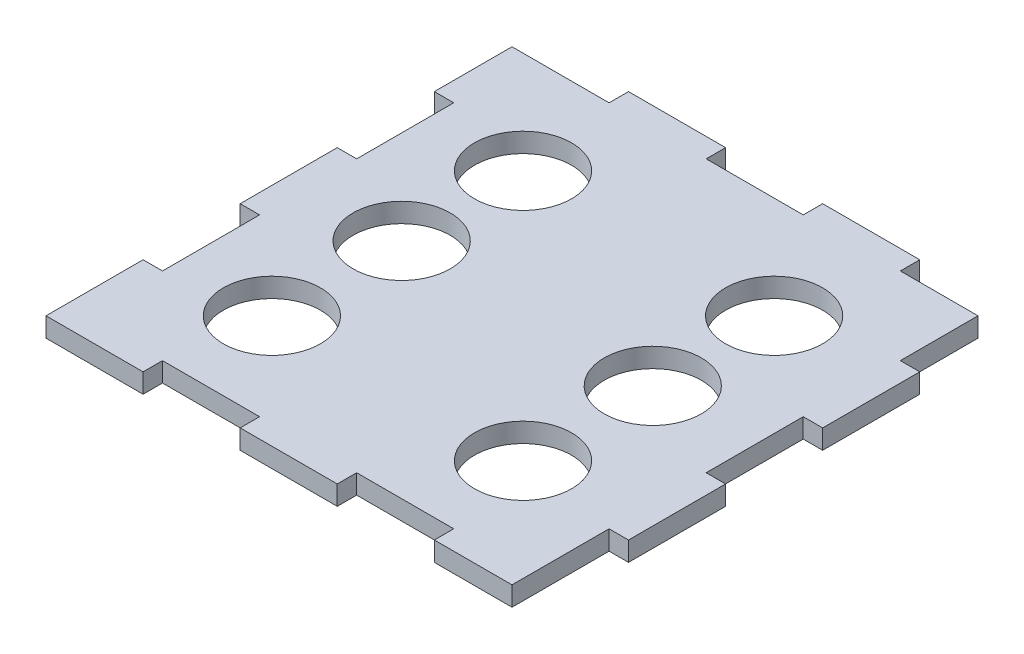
SolidWorks part; units mm, degrees
ref_plane "Front Plane" through (0, 0, 0) normal (0, 0, 1) x (1, 0, 0)
ref_plane "Top Plane" through (0, 0, 0) normal (0, 1, 0) x (1, 0, 0)
ref_plane "Right Plane" through (0, 0, 0) normal (1, 0, 0) x (0, 0, -1)
sketch "Sketch2" plane through (0, 0, 0) normal (0, 1, 0) x (1, 0, 0)
  line L1 (-50, 46) -> (-30, 46)
  line L2 (-50, 46) -> (-50, 30)
  line L3 (-50, -50) -> (-30, -50)
  line L4 (46, 46) -> (46, 30)
  line L8 (-30, 46) -> (-30, 50)
  line L9 (-30, 50) -> (-10, 50)
  line L11 (46, 30) -> (50, 30)
  line L14 (-10, 50) -> (-10, 46)
  line L15 (-10, 46) -> (10, 46)
  line L16 (10, 46) -> (10, 50)
  line L17 (10, 50) -> (30, 50)
  line L18 (30, 50) -> (30, 46)
  line L19 (30, 46) -> (46, 46)
  line L20 (-30, -50) -> (-30, -46)
  line L21 (-30, -46) -> (-10, -46)
  line L22 (-10, -46) -> (-10, -50)
  line L23 (-10, -50) -> (10, -50)
  line L24 (10, -50) -> (10, -46)
  line L25 (10, -46) -> (30, -46)
  line L26 (30, -46) -> (30, -50)
  line L27 (30, -50) -> (46, -50)
  line L29 (50, 30) -> (50, 10)
  line L30 (50, 10) -> (46, 10)
  line L31 (46, 10) -> (46, -10)
  line L32 (46, -10) -> (50, -10)
  line L33 (50, -10) -> (50, -30)
  line L34 (50, -30) -> (46, -30)
  line L35 (46, -30) -> (46, -50)
  line L36 (-50, 30) -> (-46, 30)
  line L37 (-46, 30) -> (-46, 10)
  line L38 (-46, 10) -> (-50, 10)
  line L39 (-50, 10) -> (-50, -10)
  line L40 (-50, -10) -> (-46, -10)
  line L41 (-46, -10) -> (-46, -30)
  line L42 (-46, -30) -> (-50, -30)
  line L43 (-50, -30) -> (-50, -50)
  circle A0 centre (-26.7321, 25) radius 10
  circle A1 centre (-26.7321, 0) radius 10
  circle A2 centre (-26.7321, -26.7321) radius 10
  circle A3 centre (25, 25) radius 10
  circle A4 centre (25, 0) radius 10
  circle A5 centre (25, -26.7321) radius 10
  point P0 (0, 0)
  point P62 (0, 0)
extrude "Boss-Extrude1" add sketch "Sketch2" along normal blind 4
equation "\"Slit thick\"= 4"
equation "\"Slit wide\"= 20"
equation "\"Piece Thick\"= 4"
equation "\"Slit distance\"= 20"
equation "\"D3@Sketch2\"=\"Slit distance\""
equation "\"D4@Sketch2\"=\"Slit distance\""
equation "\"D6@Sketch2\"=\"Slit wide\""
equation "\"D8@Sketch2\"=\"Slit wide\""
equation "\"D10@Sketch2\"=\"Slit wide\""
equation "\"D12@Sketch2\"=\"Slit thick\""
equation "\"D14@Sketch2\"=\"Slit thick\""
equation "\"D15@Sketch2\"=\"Slit wide\""
equation "\"D16@Sketch2\"=\"Slit distance\""
equation "\"D17@Sketch2\"=\"Slit wide\""
equation "\"D18@Sketch2\"=\"Slit distance\""
equation "\"D20@Sketch2\"=\"Slit thick\""
equation "\"D21@Sketch2\"=\"Slit wide\""
equation "\"D22@Sketch2\"=\"Slit distance\""
equation "\"D23@Sketch2\"=\"Slit wide\""
equation "\"D24@Sketch2\"=\"Slit distance\""
equation "\"diam\"= 20"
equation "\"D25@Sketch2\"=\"diam\""
equation "\"D26@Sketch2\"=\"diam\""
equation "\"D27@Sketch2\"=\"diam\""
equation "\"D28@Sketch2\"=\"diam\""
equation "\"D29@Sketch2\"=\"diam\""
equation "\"D30@Sketch2\"=\"diam\""
equation "\"D1@Boss-Extrude1\"=\"Piece Thick\""
